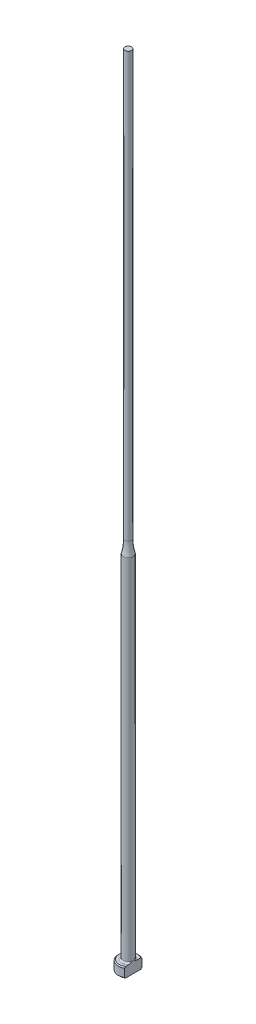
SolidWorks part; units mm, degrees
ref_plane "Front Plane" through (0, 0, 0) normal (0, 0, 1) x (1, 0, 0)
ref_plane "Top Plane" through (0, 0, 0) normal (0, 1, 0) x (1, 0, 0)
ref_plane "Right Plane" through (0, 0, 0) normal (1, 0, 0) x (0, 0, -1)
sketch "Sketch1" plane through (0, 0, 0) normal (0, 0, 1) x (1, 0, 0)
  line L0 (0, 259.9588) -> (0, -15.1925) construction
  line L1 (0, 0) -> (-2, 0)
  line L2 (-2, 0) -> (-2, 2)
  line L3 (-2, 2) -> (-1, 2)
  line L4 (-0.65, 75) -> (-0.65, 160)
  line L5 (-0.65, 160) -> (0, 160)
  line L6 (0, 160) -> (0, 0)
  line L7 (-1, 2) -> (-1, 72.3775)
  arc A0 (-1, 72.3775) -> (-0.65, 75) centre (-10.65, 75) ccw
  point P13 (-1, 0)
  dimension "D1" = 10
  dimension "L" = 160
  dimension "H" = 4
  dimension "T" = 2
  dimension "D" = 1.3
  dimension "B" = 2
  dimension "S" = 75
revolve "Revolve1" add sketch "Sketch1" angle 360 about L0
chamfer "Chamfer1" distance 0.2 angle 45 2 edges at (0, 2, 2) (0, 0, 2)
fillet "Fillet1" radius 0.3 1 edges at (0, 2, 1)
sketch "Sketch2" plane through (0, 0, 0) normal (0, 1, 0) x (1, 0, 0)
  line L0 (1, 1.7321) -> (1, -1.7321)
  circle A0 centre (0, 0) radius 2 construction
  arc A1 (1, -1.7321) -> (1, 1.7321) centre (0, 0) ccw
  circle A2 centre (0, 0) radius 1 construction
extrude "KEY" cut sketch "Sketch2" along normal through all
